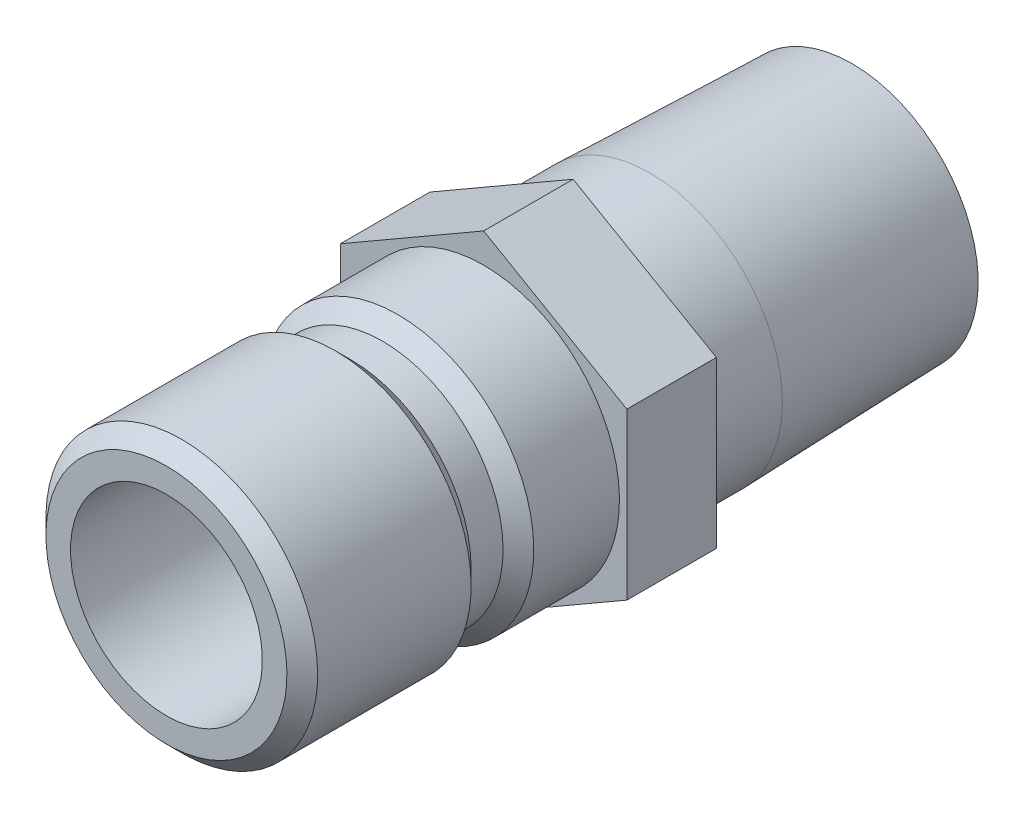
SolidWorks part; units mm, degrees
ref_plane "Front Plane" through (0, 0, 0) normal (0, 0, 1) x (1, 0, 0)
ref_plane "Top Plane" through (0, 0, 0) normal (0, 1, 0) x (1, 0, 0)
ref_plane "Right Plane" through (0, 0, 0) normal (1, 0, 0) x (0, 0, -1)
sketch "Sketch1" plane through (0, 0, 0) normal (1, 0, 0) x (0, 0, -1)
  line L0 (0, 0) -> (-18.923, 0) construction
  line L1 (-15.748, 4.7625) -> (-15.748, 5.9817)
  line L2 (-6.604, 5.9817) -> (-6.604, 0) construction
  line L3 (-14.986, 6.7437) -> (-7.366, 6.7437)
  line L4 (0, 6.5786) -> (0, 0) construction
  line L5 (-6.604, 5.9817) -> (-5.0165, 5.9817)
  line L6 (-4.2545, 6.7437) -> (0, 6.7437)
  line L7 (0, 6.7437) -> (0, 6.5786)
  line L8 (-6.604, 5.9817) -> (-7.366, 6.7437)
  line L9 (-5.0165, 5.9817) -> (-4.2545, 6.7437)
  line L10 (-15.748, 5.9817) -> (-14.986, 6.7437)
  line L11 (-15.748, 4.7625) -> (-3.556, 4.7625)
  line L12 (0, 6.5786) -> (8.255, 6.5786)
  line L13 (8.255, 6.5786) -> (18.288, 6.2651)
  line L14 (18.288, 6.2651) -> (18.288, 4.6228)
  line L15 (0, 0) -> (4.445, 0) construction
  line L17 (-3.4817, 4.6228) -> (18.288, 4.6228)
  line L18 (-3.556, 4.7625) -> (-3.4817, 4.6228)
  dimension "D1" = 15.748
  dimension "D2" = 1.5875
  dimension "D3" = 0.762
  dimension "D4" = 45
  dimension "D5" = 9.144
  dimension "D6" = 45
  dimension "D7" = 1.79
  dimension "D8" = 10.033
  dimension "D9" = 34.036
  dimension "D10" = 3.175
  dimension "D11" = 9.525
  dimension "D12" = 13.1572
  dimension "D13" = 4.445
  dimension "D14" = 13.4874
  dimension "D15" = 9.2456
  dimension "D16" = 12.192
  dimension "D17" = 118
revolve "Revolve1" add sketch "Sketch1" angle 360 about L0
sketch "Sketch2" plane through (0, 0, 0) normal (0, 0, 1) x (1, 0, 0)
  line L1 (-7.112, 4.1061) -> (-7.112, -4.1061)
  line L2 (-7.112, -4.1061) -> (0, -8.2122)
  line L3 (0, -8.2122) -> (7.112, -4.1061)
  line L4 (7.112, -4.1061) -> (7.112, 4.1061)
  line L5 (7.112, 4.1061) -> (0, 8.2122)
  line L6 (0, 8.2122) -> (-7.112, 4.1061)
  circle A0 centre (0, 0) radius 7.112 construction
  circle A1 centre (0, 0) radius 4.6228 construction
  circle A2 centre (0, 0) radius 4.6228
  dimension "D1" = 14.224
extrude "Boss-Extrude1" add sketch "Sketch2" against normal up to vertex (4.445 mm away)
